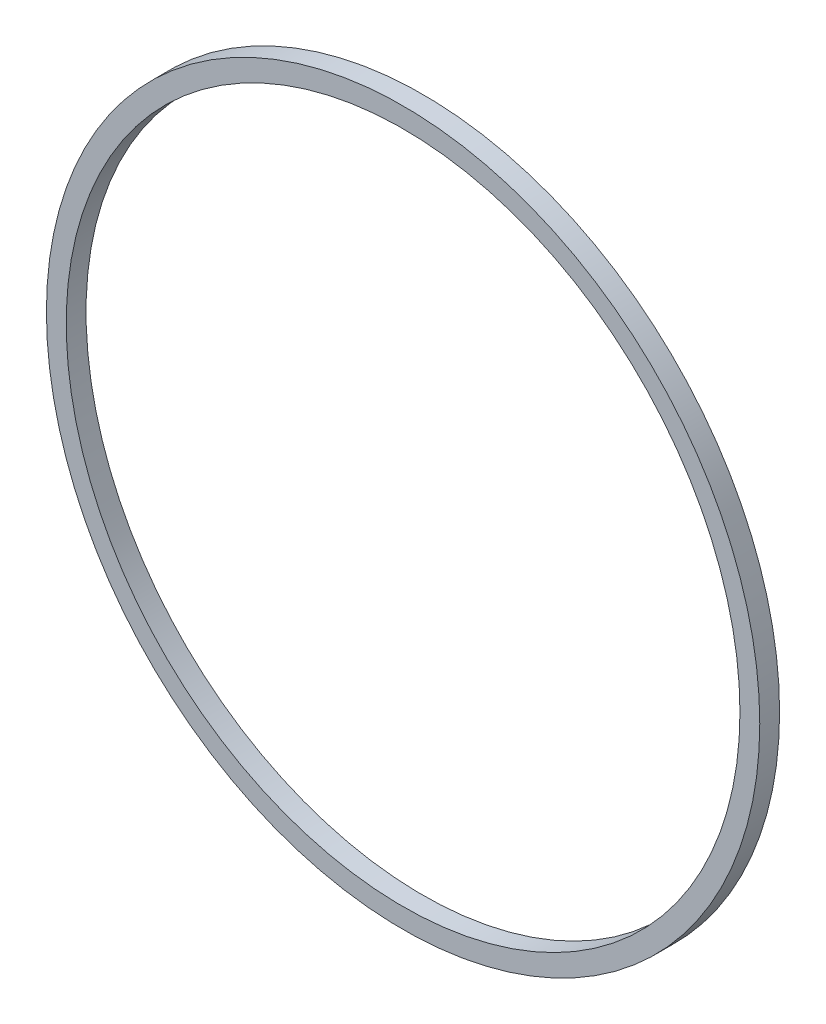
SolidWorks part; units mm, degrees
ref_plane "前基準面" through (0, 0, 0) normal (0, 0, 1) x (1, 0, 0)
ref_plane "上基準面" through (0, 0, 0) normal (0, 1, 0) x (1, 0, 0)
ref_plane "右基準面" through (0, 0, 0) normal (1, 0, 0) x (0, 0, -1)
sketch "草圖3" plane through (0, 0, 0) normal (1, 0, 0) x (0, 0, -1)
  line L0 (-2.4652, 0) -> (1.9329, 0) construction
  line L1 (-2, 34) -> (0, 34)
  line L2 (0, 34) -> (0, 36)
  line L3 (0, 36) -> (-2, 36)
  line L4 (-2, 36) -> (-2, 34)
  dimension "D1" = 68
  dimension "D2" = 2
  dimension "D3" = 72
revolve "旋轉1" add sketch "草圖3" angle 360 about L0
